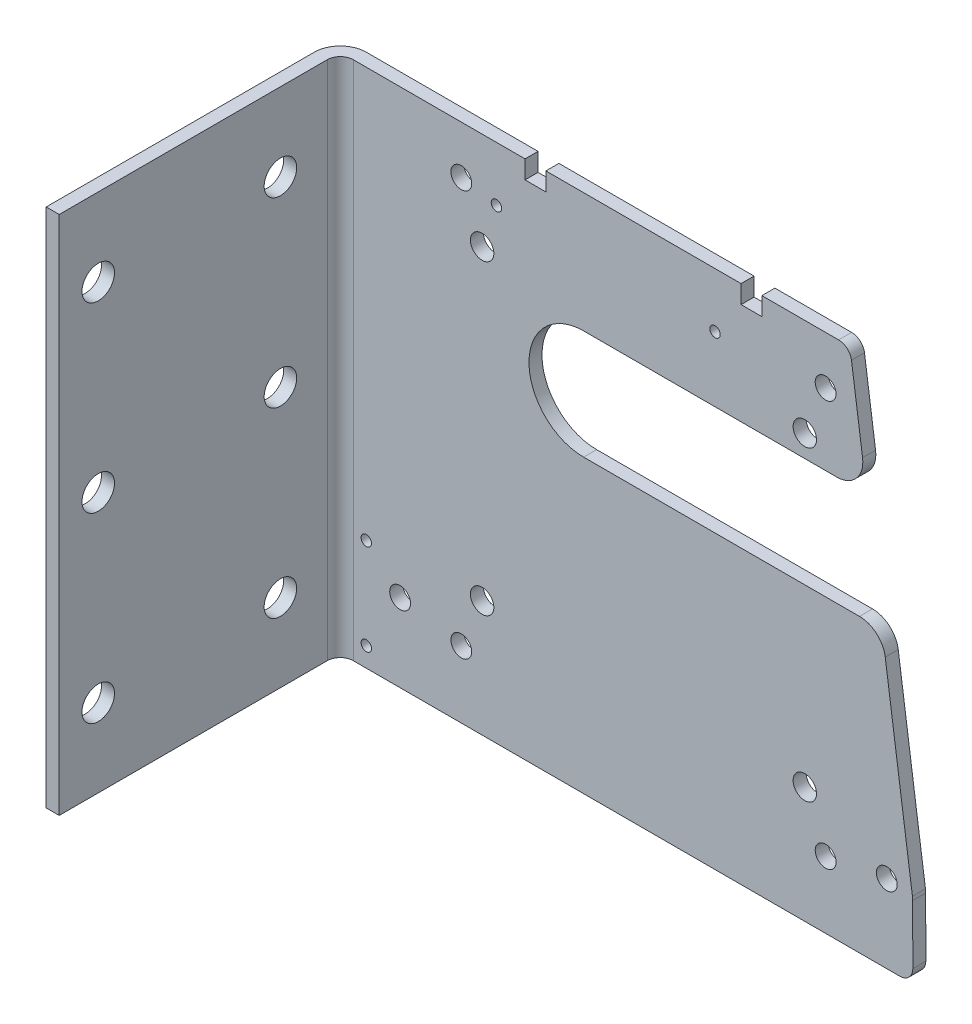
SolidWorks part; units mm, degrees
ref_plane "Plan de face" through (0, 0, 0) normal (0, 0, 1) x (1, 0, 0)
ref_plane "Plan de dessus" through (0, 0, 0) normal (0, 1, 0) x (1, 0, 0)
ref_plane "Plan de droite" through (0, 0, 0) normal (1, 0, 0) x (0, 0, -1)
sketch "Esquisse1" plane through (0, 0, 0) normal (0, 0, 1) x (1, 0, 0)
  line L0 (-121.5, 96.4) -> (-121.5, -103.6)
  line L1 (-121.5, 96.4) -> (-45.5, 96.4)
  line L2 (45.5, 96.4) -> (45.5, 89.4) construction
  line L3 (45.5, 89.4) -> (37.5, 89.4) construction
  line L4 (37.5, 89.4) -> (37.5, 96.4) construction
  line L5 (37.5, 96.4) -> (-37.5, 96.4) construction
  line L6 (-37.5, 96.4) -> (-37.5, 89.4) construction
  line L7 (-37.5, 89.4) -> (-45.5, 89.4) construction
  line L8 (-45.5, 89.4) -> (-45.5, 96.4) construction
  line L9 (45.5, 96.4) -> (45.5, 89.4)
  line L10 (45.5, 89.4) -> (37.5, 89.4)
  line L11 (37.5, 89.4) -> (37.5, 96.4)
  line L12 (37.5, 96.4) -> (-37.5, 96.4)
  line L13 (-37.5, 96.4) -> (-37.5, 89.4)
  line L14 (-37.5, 89.4) -> (-45.5, 89.4)
  line L15 (-45.5, 89.4) -> (-45.5, 96.4)
  line L16 (-121.5, -103.6) -> (98.4914, -103.6)
  line L17 (45.5, 96.4) -> (74.9805, 96.4)
  line L18 (103.5, -168.6) -> (103.5, -75.9496) construction
  line L19 (103.4513, -75.2538) -> (79.9319, 92.0959) construction
  line L20 (103.3552, -74.5698) -> (92.9044, -0.2083)
  line L21 (103.4914, -98.5914) -> (103.4525, -75.9444)
  line L22 (-22.994, 50.4) -> (74.2882, 50.4)
  line L23 (-22.994, 8.4) -> (83.0017, 8.4)
  line L24 (84.1909, 61.7917) -> (79.9319, 92.0959)
  arc A0 (74.9805, 96.4) -> (79.9319, 92.0959) centre (74.9805, 91.4) cw
  arc A1 (-22.994, 50.4) -> (-22.994, 8.4) centre (-22.994, 29.4) ccw
  arc A2 (74.2882, 50.4) -> (84.1909, 61.7917) centre (74.2882, 60.4) ccw
  arc A3 (92.9044, -0.2083) -> (83.0017, 8.4) centre (83.0017, -1.6) ccw
  arc A4 (103.3552, -74.5698) -> (103.4525, -75.9444) centre (93.4525, -75.9616) cw
  arc A5 (98.4914, -103.6) -> (103.4914, -98.5914) centre (98.4914, -98.6) ccw
  circle A6 centre (-62, -58.9) radius 4.5 construction
  circle A7 centre (62, -58.9) radius 4.5 construction
  circle A8 centre (62, 58.9) radius 4.5 construction
  circle A9 centre (-62, 58.9) radius 4.5 construction
  circle A10 centre (-62, -58.9) radius 4.5
  circle A11 centre (62, -58.9) radius 4.5
  circle A12 centre (62, 58.9) radius 4.5
  circle A13 centre (-62, 58.9) radius 4.5
  circle A14 centre (-70, 77.9) radius 4
  circle A15 centre (70, 77.9) radius 4
  circle A16 centre (93.5, -73.6) radius 4
  circle A17 centre (70, -77.9) radius 4
  circle A18 centre (-70, -77.9) radius 4
  circle A19 centre (-93.5, -73.6) radius 4
  point P26 (85.7919, 50.4)
  point P34 (103.5, -103.6)
  dimension "D2" = 5
  dimension "D4" = 42
  dimension "D5" = 10
  dimension "D6" = 5
  dimension "D7" = 8
  dimension "D8" = 8
  dimension "D9" = 8
  dimension "D10" = 8
  dimension "D11" = 8
  dimension "D12" = 8
  dimension "D1" = 200
  dimension "D3" = 225
extrude "Extrusion1" add sketch "Esquisse1" along normal blind 5
hole_wizard "Trou taraudé M4x0.71" positions "Esquisse3D1" profile "Esquisse2" tap size "M4x0.7" standard "ISO"
sketch3d "Esquisse3D1"
  line L0 (37.5, 96.4, 5) -> (-37.5, 96.4, 5) construction
  line L1 (-121.5, 96.4, 5) -> (-121.5, -103.6, 5) construction
  line L2 (-121.5, -103.6, 5) -> (98.4914, -103.6, 5) construction
  point P0 (-56.5, 75.4, 5)
  point P2 (27.5, 75.4, 5)
  point P4 (-106.5, -61.1, 5)
  point P6 (-106.5, -96.1, 5)
  dimension "D1" = 84
  dimension "D2" = 21
  dimension "D3" = 65
  dimension "D4" = 35
  dimension "D5" = 7.5
  dimension "D6" = 15
sketch "Esquisse2" plane through (-56.5, 75.4, 5) normal (1, 0, 0) x (0, -1, 0)
  line L0 (0, 0) -> (0, 11.0914)
  line L1 (0, 11.0914) -> (1.65, 10.1)
  line L2 (1.65, 10.1) -> (1.65, 8)
  line L3 (1.65, 8) -> (2, 8)
  line L4 (2, 8) -> (2, 0)
  line L5 (2, 0) -> (0, 0)
  line L10 (0, 11.0914) -> (-1.65, 10.1) construction
  line L11 (0, -6.35) -> (0, 107.95) construction
  dimension "Diamètre du trou pour taraudage" = 3.3
  dimension "Profondeur du trou pour taraudage" = 10.1
  dimension "Diamètre principal du filetage" = 4
  dimension "Profondeur du filetage" = 8
  dimension "Angle de pointe" = 118
sketch "Esquisse3" plane through (0, 0, 5) normal (0, 0, 1) x (1, 0, 0)
  line L0 (-121.5, -103.6) -> (98.4914, -103.6) construction
  line L1 (-121.5, 96.4) -> (-116.5, 96.4)
  line L2 (-121.5, 96.4) -> (-121.5, -103.6)
  line L3 (-121.5, -103.6) -> (-116.5, -103.6)
  line L4 (-116.5, 96.4) -> (-116.5, -103.6)
  dimension "D1" = 5
extrude "Extrusion2" add sketch "Esquisse3" along normal blind 108
fillet "Congé1" radius 10 1 edges at (-121.5, -3.6, 0)
fillet "Congé2" radius 5 1 edges at (-116.5, -3.6, 5)
sketch "Esquisse4" plane through (-121.5, 0, 0) normal (-1, 0, 0) x (0, 0, 1)
  line L0 (113, 96.4) -> (113, -103.6) construction
  line L2 (113, -103.6) -> (10, -103.6) construction
  circle A0 centre (28, -73.6) radius 6.25
  circle A1 centre (28, -3.6) radius 6.25
  circle A2 centre (28, 66.4) radius 6.25
  circle A3 centre (98, -3.6) radius 6.25
  circle A4 centre (98, -73.6) radius 6.25
  circle A5 centre (98, 66.4) radius 6.25
  dimension "D1" = 12.5
  dimension "D2" = 12.5
  dimension "D3" = 12.5
  dimension "D4" = 12.5
  dimension "D5" = 12.5
  dimension "D6" = 12.5
  dimension "D7" = 70
  dimension "D8" = 15
  dimension "D9" = 70
  dimension "D10" = 70
  dimension "D11" = 100
extrude "Enlèv. mat.-Extru.1" cut sketch "Esquisse4" against normal through all
